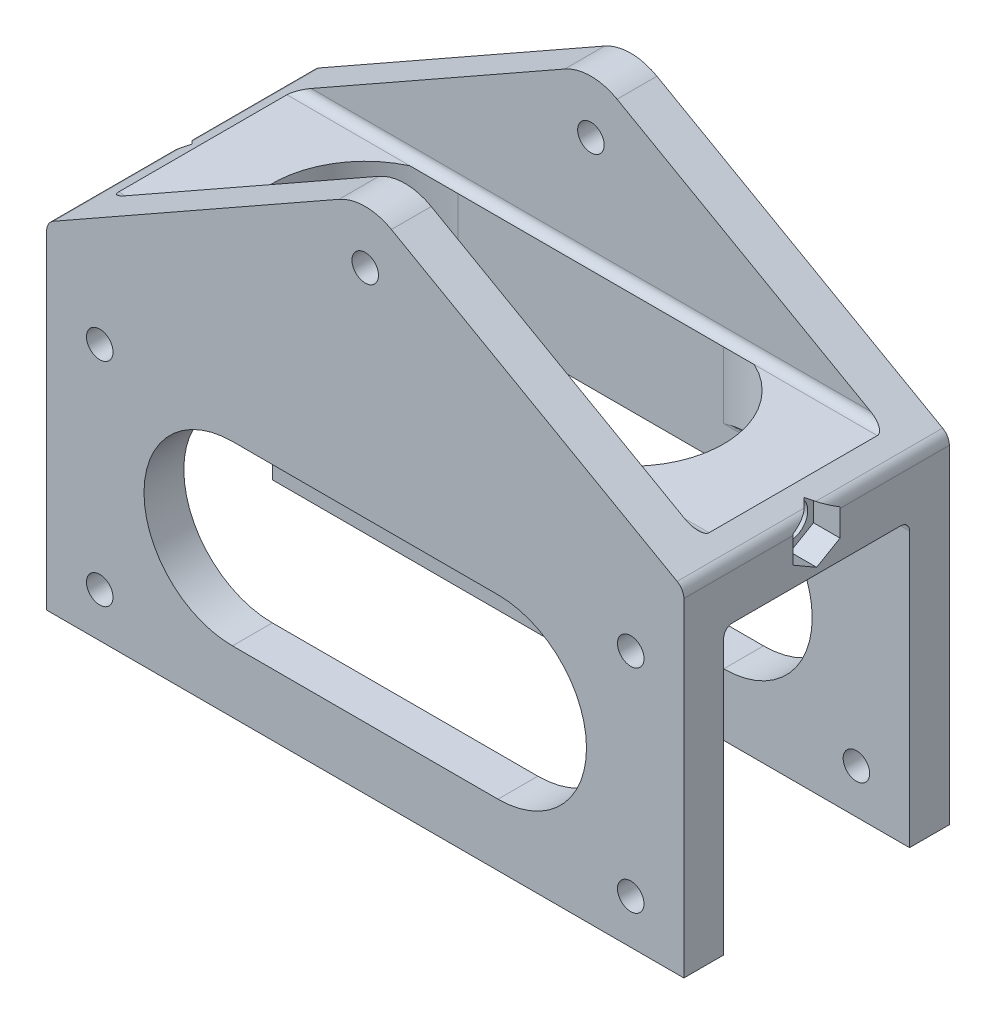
SolidWorks part; units mm, degrees
ref_plane "Plan de face" through (0, 0, 0) normal (0, 0, 1) x (1, 0, 0)
ref_plane "Plan de dessus" through (0, 0, 0) normal (0, 1, 0) x (1, 0, 0)
ref_plane "Plan de droite" through (0, 0, 0) normal (1, 0, 0) x (0, 0, -1)
sketch "Esquisse1" plane through (0, 0, 0) normal (0, 0, 1) x (1, 0, 0)
  line L0 (-60, -24) -> (60, 24) construction
  line L1 (-70.4788, 42.8618) -> (-5.9153, 79.4408)
  line L2 (72, -42) -> (-72, -42) construction
  line L3 (72, -34) -> (72, 40.2516)
  line L4 (72, 42) -> (-72, 42) construction
  line L5 (-72, -34) -> (-72, 40.2516)
  line L6 (72, -42) -> (-72, 42) construction
  line L7 (72, 42) -> (-72, -42) construction
  line L8 (5.9153, 79.4408) -> (70.4788, 42.8618)
  line L9 (-72, -34) -> (72, -34)
  line L10 (30, 0) -> (-30, 0) construction
  line L11 (30, -20) -> (-30, -20)
  line L12 (30, 20) -> (-30, 20)
  circle A0 centre (-60, -24) radius 3
  circle A1 centre (60, -24) radius 3
  circle A2 centre (60, 24) radius 3
  circle A3 centre (-60, 24) radius 3
  circle A4 centre (0, 69) radius 3
  arc A5 (5.9153, 79.4408) -> (-5.9153, 79.4408) centre (0, 69) ccw
  arc A6 (72, 40.2516) -> (70.4788, 42.8618) centre (69, 40.2516) ccw
  arc A7 (-70.4788, 42.8618) -> (-72, 40.2516) centre (-69, 40.2516) ccw
  arc A8 (30, -20) -> (30, 20) centre (30, 0) ccw
  arc A9 (-30, 20) -> (-30, -20) centre (-30, 0) ccw
  point P3 (0, 0)
  point P12 (0, 0)
  point P22 (0, 82.7921)
  point P30 (0, 0)
  dimension "D1" = 2
  dimension "D3" = 6
  dimension "D9" = 12
  dimension "D10" = 3
  dimension "D12" = 20
  dimension "D2" = 2
  dimension "D4" = 120
  dimension "D5" = 48
  dimension "D6" = 45
  dimension "D7" = 18
  dimension "D8" = 12
  dimension "D11" = 10
  dimension "D13" = 60
extrude "Boss.-Extru.1" add sketch "Esquisse1" along normal mid plane 60
sketch "Esquisse2" plane through (0, 0, 0) normal (1, 0, 0) x (0, 0, -1)
  line L0 (21, 45) -> (-21, 45)
  line L1 (21, -42) -> (-21, -42)
  line L2 (21, -42) -> (21, 30)
  line L3 (21, 30) -> (-21, 30)
  line L4 (-21, -42) -> (-21, 30)
  line L7 (21, 45) -> (21, 117)
  line L8 (21, 117) -> (-21, 117)
  line L9 (-21, 45) -> (-21, 117)
  line L10 (21, 45) -> (-21, 117) construction
  line L11 (21, 117) -> (-21, 45) construction
  line L12 (0, -6) -> (0, 81) construction
  circle A0 centre (0, 37.5) radius 4
  point P0 (0, 0)
  point P6 (0, 87)
  dimension "D4" = 8
  dimension "D1" = 42
  dimension "D2" = 72
  dimension "D5" = 15
  dimension "D6" = 30
  dimension "D7" = 7.5
  dimension "D3" = 2
extrude "Enlèv. mat.-Extru.1" cut sketch "Esquisse2" against normal through all both and the other way through all
fillet "Congé1" radius 2 4 edges at (0, 30, 21) (0, 30, -21) (0, 45, -21) (0, 45, 21)
sketch "Esquisse3" plane through (0, 0, 0) normal (1, 0, 0) x (0, 0, -1)
  line L0 (-5.3, 40.56) -> (-5.3, 53.3794)
  line L1 (0, 43.6199) -> (-5.3, 40.56) construction
  line L2 (-5.3, 40.56) -> (-5.3, 34.44)
  line L3 (-5.3, 34.44) -> (0, 31.3801)
  line L4 (0, 31.3801) -> (5.3, 34.44)
  line L5 (5.3, 34.44) -> (5.3, 40.56)
  line L6 (5.3, 40.56) -> (0, 43.6199) construction
  line L7 (-5.3, 53.3794) -> (5.3, 53.3794)
  line L8 (5.3, 53.3794) -> (5.3, 40.56)
  circle A0 centre (0, 37.5) radius 5.3 construction
  dimension "D1" = 10.6
extrude "Enlèv. mat.-Extru.2" cut sketch "Esquisse3" against normal mid plane 6.2
sketch "Esquisse4" plane through (-72, 0, 0) normal (-1, 0, 0) x (0, 0, 1)
  line L1 (0, 43.6199) -> (-5.3, 40.56)
  line L2 (-5.3, 40.56) -> (-5.3, 34.44)
  line L3 (-5.3, 34.44) -> (0, 31.3801)
  line L4 (0, 31.3801) -> (5.3, 34.44)
  line L5 (5.3, 34.44) -> (5.3, 40.56)
  line L6 (5.3, 40.56) -> (0, 43.6199)
  circle A0 centre (0, 37.5) radius 5.3 construction
  dimension "D1" = 10.6
extrude "Enlèv. mat.-Extru.3" cut sketch "Esquisse4" against normal blind 6
mirror "Symétrie1" about plane through (0, 0, 0) normal (1, 0, 0) of "Enlèv. mat.-Extru.3"
sketch "Esquisse5" plane through (0, 45, 0) normal (0, 1, 0) x (1, 0, 0)
  line L0 (30, 0) -> (-30, 0) construction
  line L1 (30, -21) -> (-30, -21)
  line L2 (30, 21) -> (-30, 21)
  line L3 (-63.1748, 21) -> (63.1748, 21) construction
  arc A0 (30, -21) -> (30, 21) centre (30, 0) ccw
  arc A1 (-30, 21) -> (-30, -21) centre (-30, 0) ccw
  point P2 (0, 0)
  dimension "D1" = 60
extrude "Enlèv. mat.-Extru.4" cut sketch "Esquisse5" against normal through all
